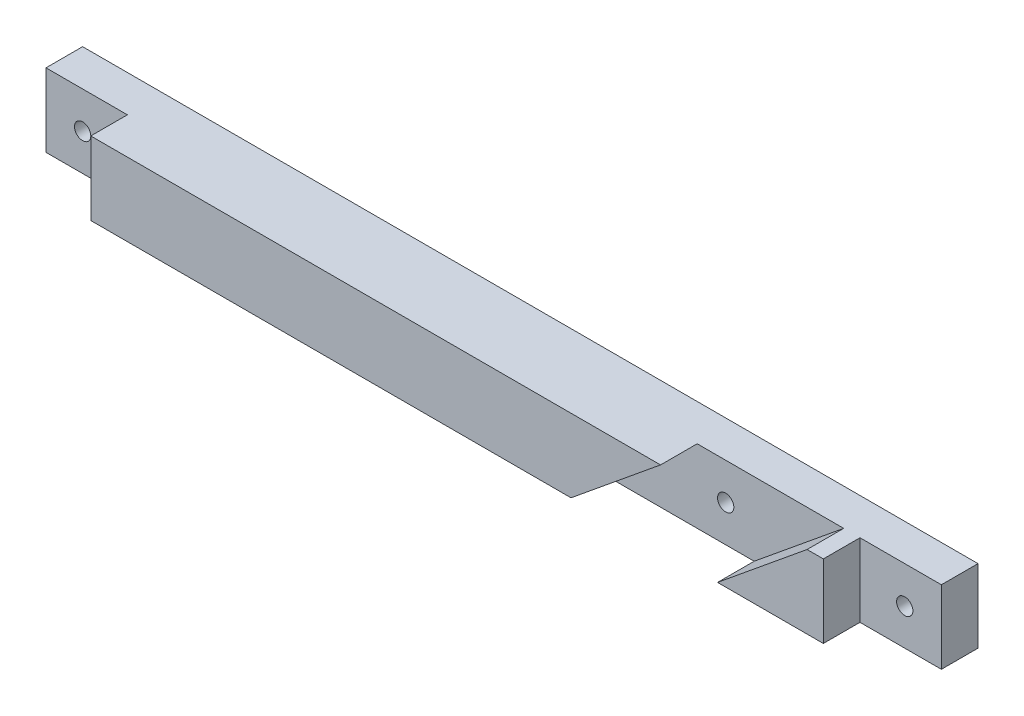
SolidWorks part; units mm, degrees
ref_plane "Face" through (0, 0, 0) normal (0, 0, 1) x (1, 0, 0)
ref_plane "Dessus" through (0, 0, 0) normal (0, 1, 0) x (1, 0, 0)
ref_plane "Droite" through (0, 0, 0) normal (1, 0, 0) x (0, 0, -1)
sketch "Esquisse1" plane through (0, 0, 0) normal (0, 0, 1) x (1, 0, 0)
  line L1 (-67.2717, -109.6176) -> (42.7283, -109.6176)
  line L2 (-67.2717, -109.6176) -> (-67.2717, -100.6176)
  line L3 (-67.2717, -100.6176) -> (42.7283, -100.6176)
  line L4 (42.7283, -109.6176) -> (42.7283, -100.6176)
  dimension "D1" = 110
  dimension "D2" = 9
extrude "Extrusion1" add sketch "Esquisse1" along normal blind 9
sketch "Esquisse2" plane through (0, 0, 9) normal (0, 0, 1) x (1, 0, 0)
  line L0 (42.7283, -100.6176) -> (-67.2717, -100.6176) construction
  line L1 (-67.2717, -109.6176) -> (-57.2717, -109.6176)
  line L2 (-67.2717, -109.6176) -> (-67.2717, -100.6176)
  line L3 (-67.2717, -100.6176) -> (-57.2717, -100.6176)
  line L4 (-57.2717, -109.6176) -> (-57.2717, -100.6176)
  line L6 (42.7283, -109.6176) -> (32.7283, -109.6176)
  line L7 (42.7283, -109.6176) -> (42.7283, -100.6176)
  line L8 (42.7283, -100.6176) -> (32.7283, -100.6176)
  line L9 (32.7283, -109.6176) -> (32.7283, -100.6176)
  dimension "D1" = 10
  dimension "D2" = 10
extrude "Enlèv. mat.-Extru.1" cut sketch "Esquisse2" against normal blind 4.5
sketch "Esquisse4" plane through (0, 0, 4.5) normal (0, 0, 1) x (1, 0, 0)
  line L0 (42.7283, -109.6176) -> (42.7283, -100.6176) construction
  line L1 (32.7283, -109.6176) -> (42.7283, -109.6176) construction
  circle A0 centre (38.2284, -105.1454) radius 1
  point P2 (42.7283, -105.1176)
  point P5 (37.7283, -109.6176)
  dimension "D3" = 2
  dimension "D1" = 4.5
  dimension "D2" = 4.5
extrude "Enlèv. mat.-Extru.2" cut sketch "Esquisse4" against normal blind 4.5
sketch "Esquisse5" plane through (0, 0, 4.5) normal (0, 0, 1) x (1, 0, 0)
  line L0 (-67.2717, -109.6176) -> (-57.2717, -109.6176) construction
  line L1 (-67.2717, -100.6176) -> (-67.2717, -109.6176) construction
  circle A0 centre (-62.7717, -105.1176) radius 1
  dimension "D1" = 2
  dimension "D2" = 4.5
  dimension "D3" = 4.5
extrude "Enlèv. mat.-Extru.3" cut sketch "Esquisse5" against normal blind 4.5
sketch "Esquisse6" plane through (0, 0, 9) normal (0, 0, 1) x (1, 0, 0)
  line L0 (12.7283, -100.6176) -> (30.7283, -100.6176)
  line L1 (32.7283, -100.6176) -> (-57.2717, -100.6176) construction
  line L2 (30.7283, -100.6176) -> (19.7283, -109.6176)
  line L3 (-57.2717, -109.6176) -> (32.7283, -109.6176) construction
  line L4 (19.7283, -109.6176) -> (1.7283, -109.6176)
  line L5 (1.7283, -109.6176) -> (12.7283, -100.6176)
  dimension "D1" = 12
  dimension "D2" = 18
  dimension "D3" = 23
  dimension "D4" = 18
extrude "Enlèv. mat.-Extru.4" cut sketch "Esquisse6" against normal blind 4.5
sketch "Esquisse7" plane through (0, 0, 4.5) normal (0, 0, 1) x (1, 0, 0)
  circle A0 centre (16.2283, -105.1176) radius 1
  dimension "D1" = 2
extrude "Enlèv. mat.-Extru.5" cut sketch "Esquisse7" against normal blind 4.5
